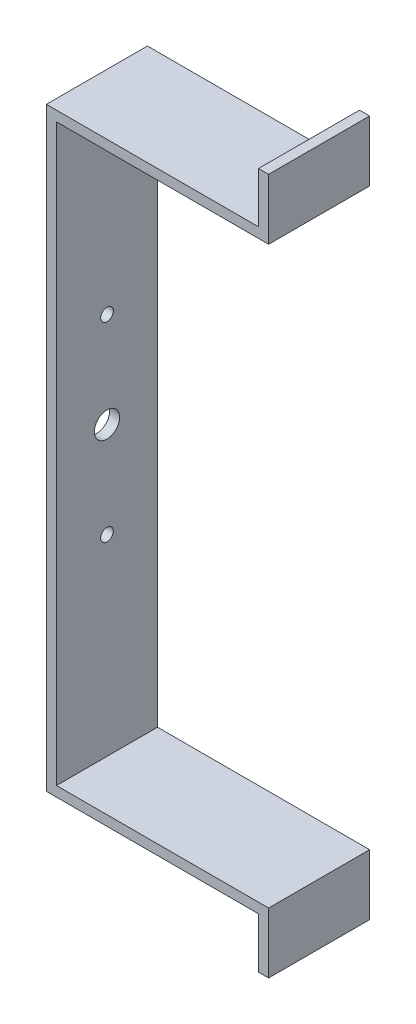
SolidWorks part; units mm, degrees
ref_plane "Front" through (0, 0, 0) normal (0, 0, 1) x (1, 0, 0)
ref_plane "Top" through (0, 0, 0) normal (0, 1, 0) x (1, 0, 0)
ref_plane "Right" through (0, 0, 0) normal (1, 0, 0) x (0, 0, -1)
sketch "Sketch1" plane through (0, 0, 0) normal (0, 0, 1) x (1, 0, 0)
  line L0 (53.34, -74.803) -> (53.34, -87.503)
  line L1 (0, 0) -> (34.0061, 0) construction
  line L2 (53.34, 74.803) -> (53.34, 87.503)
  line L21 (53.34, 74.803) -> (0, 74.803)
  line L22 (0, 74.803) -> (0, -74.803)
  line L23 (0, -74.803) -> (53.34, -74.803)
  dimension "D1" = 149.606
  dimension "D2" = 53.34
  dimension "D3" = 12.7
extrude "Base-Extrude-Thin" add sketch "Sketch1" along normal mid plane 25.4 thin
sketch "Sketch2" plane through (2.54, 0, 0) normal (1, 0, 0) x (0, 0, -1)
  circle A0 centre (0, 0) radius 3.175
  dimension "D1" = 6.35
extrude "Cut-Extrude1" cut sketch "Sketch2" against normal through all
sketch "Sketch3" plane through (0, 0, 0) normal (-1, 0, 0) x (0, 0, 1)
  circle A0 centre (0, 23.9776) radius 1.5875 construction
  circle A1 centre (0, 23.9776) radius 1.5875
extrude "Cut-Extrude2" cut sketch "Sketch3" against normal through all
sketch "Sketch4" plane through (0, 0, 0) normal (-1, 0, 0) x (0, 0, 1)
  circle A0 centre (0, -23.9776) radius 1.5875 construction
  circle A1 centre (0, -23.9776) radius 1.5875
extrude "Cut-Extrude3" cut sketch "Sketch4" against normal through all
